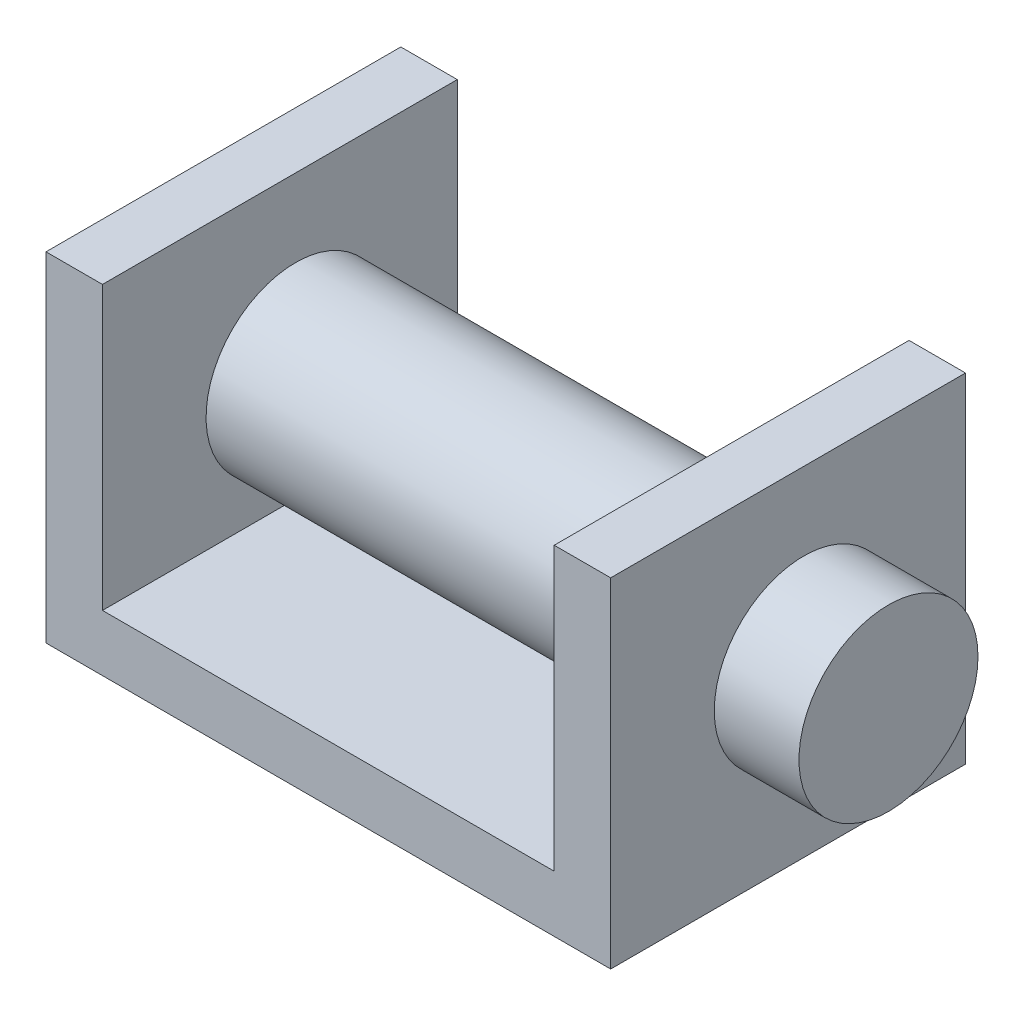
SolidWorks part; units mm, degrees
ref_plane "Front" through (0, 0, 0) normal (0, 0, 1) x (1, 0, 0)
ref_plane "Top" through (0, 0, 0) normal (0, 1, 0) x (1, 0, 0)
ref_plane "Right" through (0, 0, 0) normal (1, 0, 0) x (0, 0, -1)
sketch "Sketch3" plane through (0, 0, 0) normal (0, 0, 1) x (1, 0, 0)
  line L0 (-50, 60) -> (-50, 0)
  line L1 (-50, 0) -> (50, 0)
  line L2 (50, 0) -> (50, 60)
  line L3 (40, 10) -> (40, 60)
  line L4 (-40, 10) -> (40, 10)
  line L5 (-40, 60) -> (-40, 10)
  line L6 (40, 60) -> (50, 60)
  line L7 (-50, 60) -> (-40, 60)
  dimension "D2" = 60
  dimension "D3" = 100
  dimension "D1" = 10
extrude "Extrude1" add sketch "Sketch3" along normal mid plane 62.8345
ref_plane "Plane2" through (65, 0, 0) normal (1, 0, 0) x (0, 0, -1)
sketch "Sketch4" plane through (65, 0, 0) normal (1, 0, 0) x (0, 0, -1)
  circle A0 centre (2.78, 30.4041) radius 15.8523
extrude "Boss-Extrude1" add sketch "Sketch4" against normal through all
